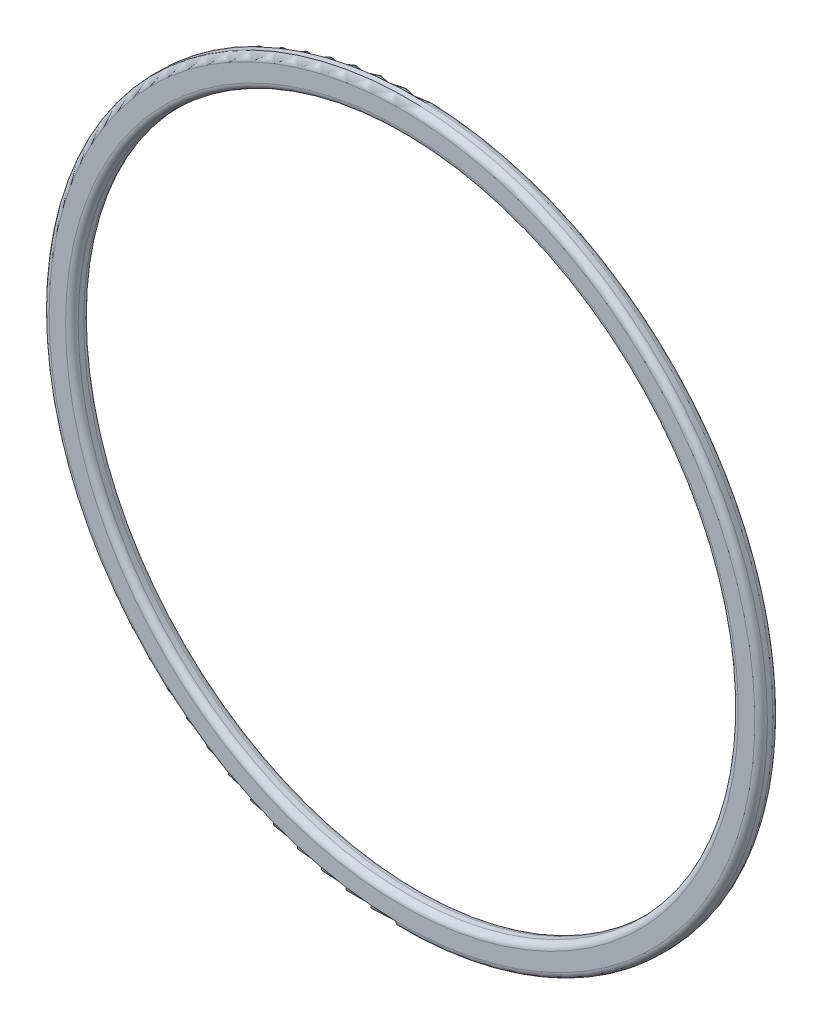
SolidWorks part; units mm, degrees
ref_plane "Plan de face" through (0, 0, 0) normal (0, 0, 1) x (1, 0, 0)
ref_plane "Plan de dessus" through (0, 0, 0) normal (0, 1, 0) x (1, 0, 0)
ref_plane "Plan de droite" through (0, 0, 0) normal (1, 0, 0) x (0, 0, -1)
sketch "Esquisse1" plane through (0, 0, 0) normal (0, 0, 1) x (1, 0, 0)
  circle A0 centre (0, 0) radius 22.375
  dimension "D1" = 44.75
sketch "Esquisse2" plane through (0, 0, 0) normal (0, 1, 0) x (1, 0, 0)
  line L1 (-22.45, 0.6285) -> (-21.4, 0.6285)
  line L2 (-22.85, 0.2285) -> (-22.85, -0.1215)
  line L3 (-22.45, -0.5215) -> (-21.4, -0.5215)
  line L4 (-21, 0.2285) -> (-21, -0.1215)
  arc A0 (-21, 0.2285) -> (-21.4, 0.6285) centre (-21.4, 0.2285) ccw
  arc A1 (-21, -0.1215) -> (-21.4, -0.5215) centre (-21.4, -0.1215) cw
  arc A2 (-22.45, -0.5215) -> (-22.85, -0.1215) centre (-22.45, -0.1215) cw
  arc A3 (-22.85, 0.2285) -> (-22.45, 0.6285) centre (-22.45, 0.2285) cw
  dimension "D4" = 0.4
  dimension "D1" = 1.15
  dimension "D2" = 21
  dimension "D3" = 22.85
sweep "Balayage1" add profiles "Esquisse2" path "Esquisse1"
